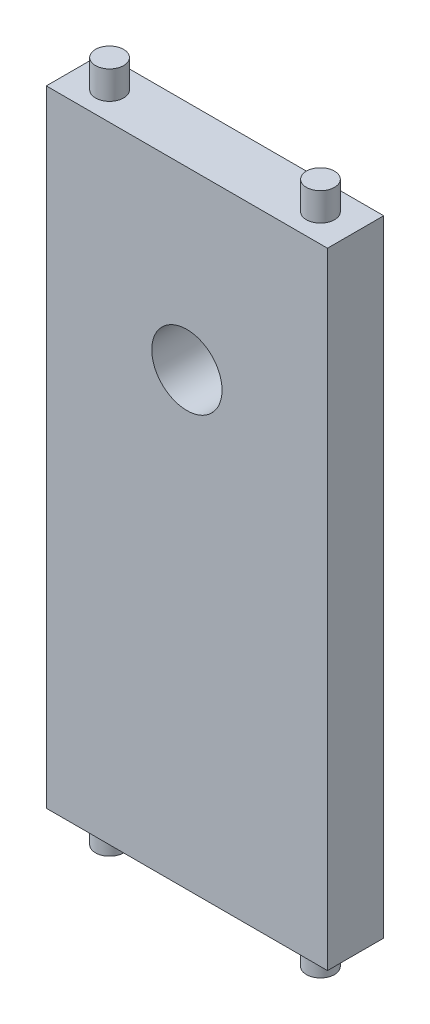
SolidWorks part; units mm, degrees
ref_plane "Front Plane" through (0, 0, 0) normal (0, 0, 1) x (1, 0, 0)
ref_plane "Top Plane" through (0, 0, 0) normal (0, 1, 0) x (1, 0, 0)
ref_plane "Right Plane" through (0, 0, 0) normal (1, 0, 0) x (0, 0, -1)
sketch "Sketch1" plane through (0, 0, 0) normal (0, 0, 1) x (1, 0, 0)
  line L1 (-10, -22.25) -> (10, -22.25)
  line L2 (-10, -22.25) -> (-10, 22.25)
  line L3 (-10, 22.25) -> (10, 22.25)
  line L4 (10, -22.25) -> (10, 22.25)
  line L5 (-10, -22.25) -> (10, 22.25) construction
  line L6 (-10, 22.25) -> (10, -22.25) construction
  circle A0 centre (0, 9.75) radius 2.5
  point P0 (0, 0)
  dimension "D3" = 5
  dimension "D1" = 20
  dimension "D2" = 44.5
  dimension "D4" = 32
extrude "Boss-Extrude1" add sketch "Sketch1" along normal blind 4
sketch "Sketch2" plane through (0, 22.25, 0) normal (0, 1, 0) x (1, 0, 0)
  line L2 (-7.5, -2) -> (7.5, -2) construction
  line L3 (0, 0) -> (0, -4) construction
  line L4 (10, 0) -> (-10, 0) construction
  line L5 (10, -4) -> (-10, -4) construction
  circle A0 centre (-7.5, -2) radius 1
  circle A1 centre (7.5, -2) radius 1
  point P8 (0, -2)
  dimension "D2" = 2
  dimension "D1" = 15
extrude "Boss-Extrude2" add sketch "Sketch2" along normal blind 2
mirror "Mirror1" about plane through (0, 0, 0) normal (0, 1, 0) of "Boss-Extrude2"
